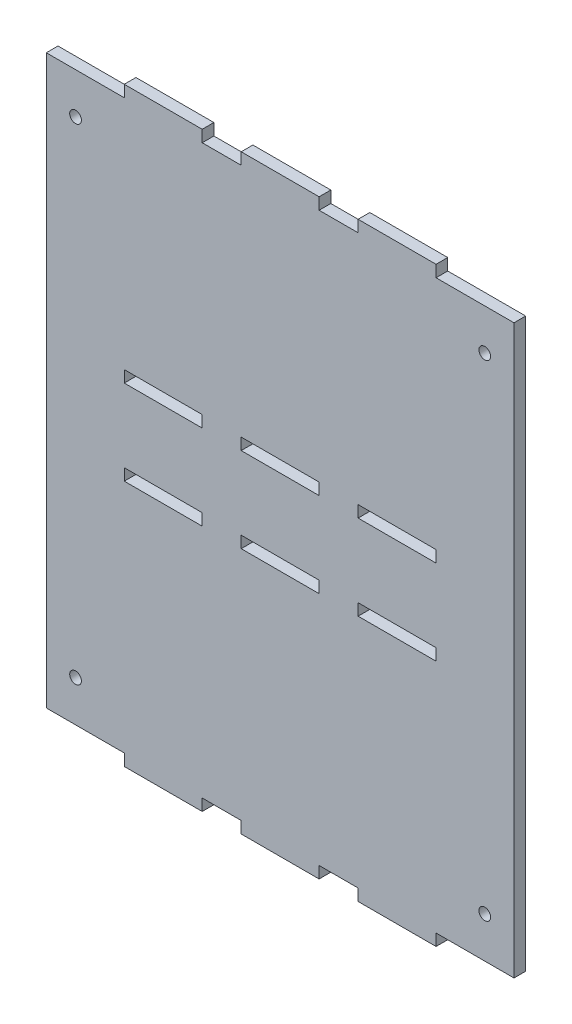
SolidWorks part; units mm, degrees
ref_plane "Plan de face" through (0, 0, 0) normal (0, 0, 1) x (1, 0, 0)
ref_plane "Plan de dessus" through (0, 0, 0) normal (0, 1, 0) x (1, 0, 0)
ref_plane "Plan de droite" through (0, 0, 0) normal (1, 0, 0) x (0, 0, -1)
sketch "Esquisse1" plane through (0, 0, 0) normal (0, 0, 1) x (1, 0, 0)
  line L0 (-10, 0) -> (10, 0)
  line L1 (60, -3) -> (60, -148.6)
  line L2 (10, 0) -> (10, -3)
  line L3 (10, -3) -> (20, -3)
  line L4 (20, -3) -> (20, 0)
  line L5 (20, 0) -> (40, 0)
  line L6 (40, 0) -> (40, -3)
  line L7 (40, -3) -> (60, -3)
  line L8 (60, -3) -> (60, -13.5)
  line L9 (60, -13.5) -> (52.5, -13.5) construction
  line L10 (60, -75.8) -> (60, -66.4) construction
  line L11 (60, -66.4) -> (40, -66.4) construction
  line L12 (40, -66.4) -> (40, -63.4)
  line L13 (40, -63.4) -> (20, -63.4)
  line L14 (20, -63.4) -> (20, -66.4)
  line L15 (20, -66.4) -> (40, -66.4)
  line L16 (20, -63.4) -> (10, -63.4) construction
  line L17 (10, -63.4) -> (10, -66.4)
  line L18 (10, -66.4) -> (-10, -66.4)
  line L19 (10, -63.4) -> (-10, -63.4)
  line L20 (0, 0) -> (0, -12.5313) construction
  line L21 (60, -75.8) -> (-14.6251, -75.8) construction
  line L22 (-10, -63.4) -> (-10, -66.4)
  line L23 (-20, -63.4) -> (-20, -66.4)
  line L24 (-40, -63.4) -> (-20, -63.4)
  line L25 (-40, -66.4) -> (-40, -63.4)
  line L26 (-20, -66.4) -> (-40, -66.4)
  line L27 (-60, -3) -> (-60, -148.6)
  line L28 (-40, -3) -> (-60, -3)
  line L29 (-40, 0) -> (-40, -3)
  line L30 (-20, 0) -> (-40, 0)
  line L31 (-20, -3) -> (-20, 0)
  line L32 (-10, -3) -> (-20, -3)
  line L33 (-10, 0) -> (-10, -3)
  line L34 (-40, -88.2) -> (-20, -88.2)
  line L35 (-40, -85.2) -> (-40, -88.2)
  line L36 (-20, -85.2) -> (-40, -85.2)
  line L37 (-20, -88.2) -> (-20, -85.2)
  line L38 (10, -88.2) -> (10, -85.2)
  line L39 (10, -88.2) -> (-10, -88.2)
  line L40 (-10, -88.2) -> (-10, -85.2)
  line L41 (10, -85.2) -> (-10, -85.2)
  line L42 (20, -88.2) -> (20, -85.2)
  line L43 (40, -88.2) -> (20, -88.2)
  line L44 (40, -85.2) -> (40, -88.2)
  line L45 (20, -85.2) -> (40, -85.2)
  line L46 (40, -148.6) -> (60, -148.6)
  line L47 (40, -151.6) -> (40, -148.6)
  line L48 (20, -148.6) -> (20, -151.6)
  line L49 (20, -151.6) -> (40, -151.6)
  line L50 (10, -148.6) -> (20, -148.6)
  line L51 (10, -151.6) -> (10, -148.6)
  line L52 (-10, -151.6) -> (10, -151.6)
  line L53 (-10, -151.6) -> (-10, -148.6)
  line L54 (-10, -148.6) -> (-20, -148.6)
  line L55 (-20, -148.6) -> (-20, -151.6)
  line L56 (-20, -151.6) -> (-40, -151.6)
  line L57 (-40, -151.6) -> (-40, -148.6)
  line L58 (-40, -148.6) -> (-60, -148.6)
  circle A0 centre (52.5, -13.5) radius 1.5
  circle A1 centre (-52.5, -13.5) radius 1.5
  circle A2 centre (52.5, -138.1) radius 1.5
  circle A3 centre (-52.5, -138.1) radius 1.5
  point P25 (0, -66.4)
  point P26 (0, -63.4)
  point P70 (-60, -75.8)
  dimension "D11" = 3
  dimension "D1" = 3
  dimension "D2" = 10
  dimension "D3" = 10
  dimension "D5" = 20
  dimension "D6" = 3
  dimension "D7" = 3
  dimension "D8" = 72.8
  dimension "D9" = 10.5
  dimension "D10" = 7.5
  dimension "D12" = 9.4
  dimension "D13" = 20
  dimension "D14" = 3
  dimension "D15" = 20
  dimension "D16" = 10
  dimension "D17" = 3
  dimension "D18" = 10
extrude "Boss.-Extru.1" add sketch "Esquisse1" along normal blind 3 contours L58 L57 L56 L55 L54 L53 L52 L51 L50 L48 L49 L47 L46 L1 L7 L6 L5 L4 L3 L2 L0 L33 L32 L31 L30 L29 L28 L27 A3 A1 A0 L41 L38 L39 L40 L37 L34 L35 L36 L22 L19 L17 L18
